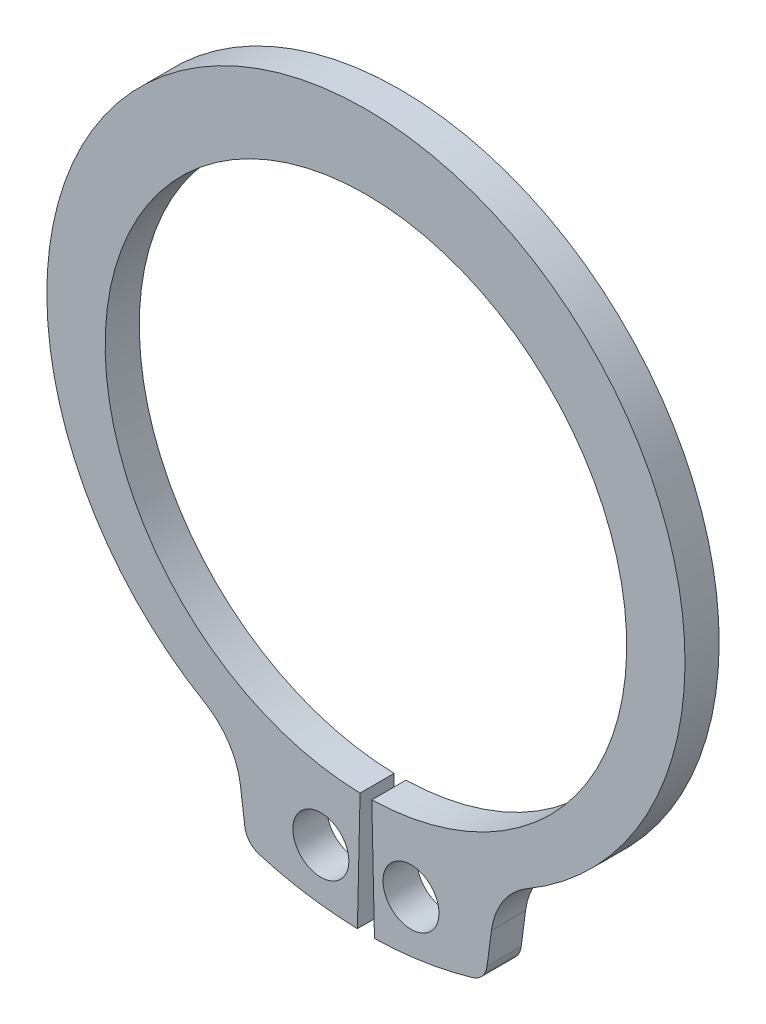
SolidWorks part; units mm, degrees
ref_plane "Plane1" through (0, 0, 0) normal (0, 0, 1) x (1, 0, 0)
ref_plane "Plane2" through (0, 0, 0) normal (0, 1, 0) x (1, 0, 0)
ref_plane "Plane3" through (0, 0, 0) normal (1, 0, 0) x (0, 0, -1)
extrude "Body" add sketch "BodySke" against normal blind 0.635
sketch "BodySke" plane through (0, 0, 0) normal (0, 0, 1) x (1, 0, 0)
  line L0 (-1.5431, 0) -> (1.5431, 0) construction
  line L1 (0, 0) -> (0, 6.223) construction
  line L2 (0.1091, -4.8502) -> (0.1588, -7.0594)
  line L3 (-0.1091, -4.8502) -> (-0.1588, -7.0594)
  line L4 (0, 0) -> (3.6944, -6.0177) construction
  line L5 (0, 0) -> (-3.6944, -6.0177) construction
  line L7 (2.3349, -5.8387) -> (2.2529, -6.4614)
  line L8 (-2.3349, -5.8387) -> (-2.2529, -6.4614)
  circle A0 centre (0, 0) radius 4.8514 construction
  arc A1 (0.1091, -4.8502) -> (-0.1091, -4.8502) centre (0, 0) ccw
  arc A2 (2.9768, -4.8488) -> (-2.9768, -4.8488) centre (0, 0.287) ccw construction
  arc A3 (0.1588, -7.0594) -> (1.9821, -6.7773) centre (0, 0) ccw
  arc A4 (3.0011, -4.8346) -> (2.3349, -5.8387) centre (3.6944, -6.0177) ccw
  arc A5 (-2.3349, -5.8387) -> (-3.0011, -4.8346) centre (-3.6944, -6.0177) ccw
  arc A6 (-1.9821, -6.7773) -> (-0.1588, -7.0594) centre (0, 0) ccw
  arc A7 (3.0011, -4.8346) -> (-3.0011, -4.8346) centre (0, 0.287) ccw
  arc A8 (-2.3619, -5.6336) -> (2.3619, -5.6336) centre (0, 0) ccw construction
  circle A9 centre (0.8382, -6.0509) radius 0.5207
  circle A10 centre (-0.8382, -6.0509) radius 0.5207
  arc A11 (2.2529, -6.4614) -> (1.9821, -6.7773) centre (1.8751, -6.4116) cw
  arc A12 (-2.2529, -6.4614) -> (-1.9821, -6.7773) centre (-1.8751, -6.4116) ccw
  point P28 (2.2211, -6.7028)
  point P31 (-2.2211, -6.7028)
  dimension "GrooveDia" = 9.7028
  dimension "D3" = 0.381
  dimension "LugRad" = 7.0612
  dimension "HoleOffsetRad" = 6.1087
  dimension "HoleDia" = 1.0414
  dimension "D2" = 15
  dimension "LargeRad" = 6.223
  dimension "SmallRad" = 5.6896
  dimension "Gap" = 0.3175
  dimension "SmallAngle" = 63.093
  dimension "HoleSpacing" = 1.6764
sketch "Clipboard" plane through (0, 0, 0) normal (0, 0, 1) x (1, 0, 0)
  line L0 (0, 0) -> (1.3716, 0)
  line L1 (0, 0) -> (0, 0.8382)
  line L2 (0, 0) -> (0, -2.2098)
  circle A0 centre (0, 0) radius 0.5207
  circle A1 centre (0, 0) radius 5.1562
  dimension "HoleDia" = 1.0414
  dimension "ShaftDia" = 10.3124
  dimension "LargeSection" = 1.3716
  dimension "SmallSection" = 0.8382
  dimension "LugSection" = 2.2098
sketch "NotSke" plane through (0, 0, 0) normal (0, 0, 1) x (1, 0, 0)
  line L0 (0.8382, -5.5302) -> (0.8382, -6.5716)
  line L1 (0.8382, -6.5716) -> (-0.8382, -6.5716)
  line L2 (-0.8382, -6.5716) -> (-0.8382, -5.5302)
  line L3 (-0.8382, -5.5302) -> (0.8382, -5.5302)
  circle A0 centre (0.8382, -6.0509) radius 0.5207 construction
  circle A1 centre (-0.8382, -6.0509) radius 0.5207 construction
extrude "Notch" [suppressed] cut sketch "NotSke" against normal through all
equation "' \"ShaftDia@Clipboard\" = 0.125"
equation "' \"Thickness@Body\" = 0.01"
equation "' \"GrooveDia@BodySke\" = 0.117"
equation "' \"LugSection@Clipboard\" = 0.046"
equation "' \"LargeSection@Clipboard\" = 0.018"
equation "' \"SmallSection@Clipboard\" = 0.011"
equation "' \"HoleDia@Clipboard\" = 0.026"
equation "' \"ShaftDia@Clipboard\" = 0.394"
equation "' \"Thickness@Body\" = 0.025"
equation "' \"GrooveDia@BodySke\" = 0.369"
equation "' \"LugSection@Clipboard\" = 0.087"
equation "' \"LargeSection@Clipboard\" = 0.052"
equation "' \"SmallSection@Clipboard\" = 0.031"
equation "' \"HoleDia@Clipboard\" = 0.041"
equation "\"Gap@BodySke\" =  \"Thickness@Body\" / 2"
equation "\"LargeRad@BodySke\" =  \"GrooveDia@BodySke\" / 2 +  \"LargeSection@Clipboard\""
equation "\"SmallRad@BodySke\" =  \"GrooveDia@BodySke\" / 2 +  \"SmallSection@Clipboard\""
equation "\"LugRad@BodySke\" = \"GrooveDia@BodySke\" / 2 + \"LugSection@Clipboard\""
equation "\"HoleOffsetRad@BodySke\" = (  \"ShaftDia@Clipboard\" / 2 + \"LugRad@BodySke\" ) / 2"
equation "\"HoleSpacing@BodySke\" = \"Gap@BodySke\"  * 2 +  \"HoleDia@Clipboard\""
equation "\"HoleDia@BodySke\" =  \"HoleDia@Clipboard\""
equation "\"SmallAngle@BodySke\" = atn(\"HoleSpacing@BodySke\" / 2 / sqr(\"HoleOffsetRad@BodySke\"  * \"HoleOffsetRad@BodySke\" - (\"HoleSpacing@BodySke\" / 2) * (\"HoleSpacing@BodySke\" / 2) ))  * 8 * ( 180 / 3.141593)"
